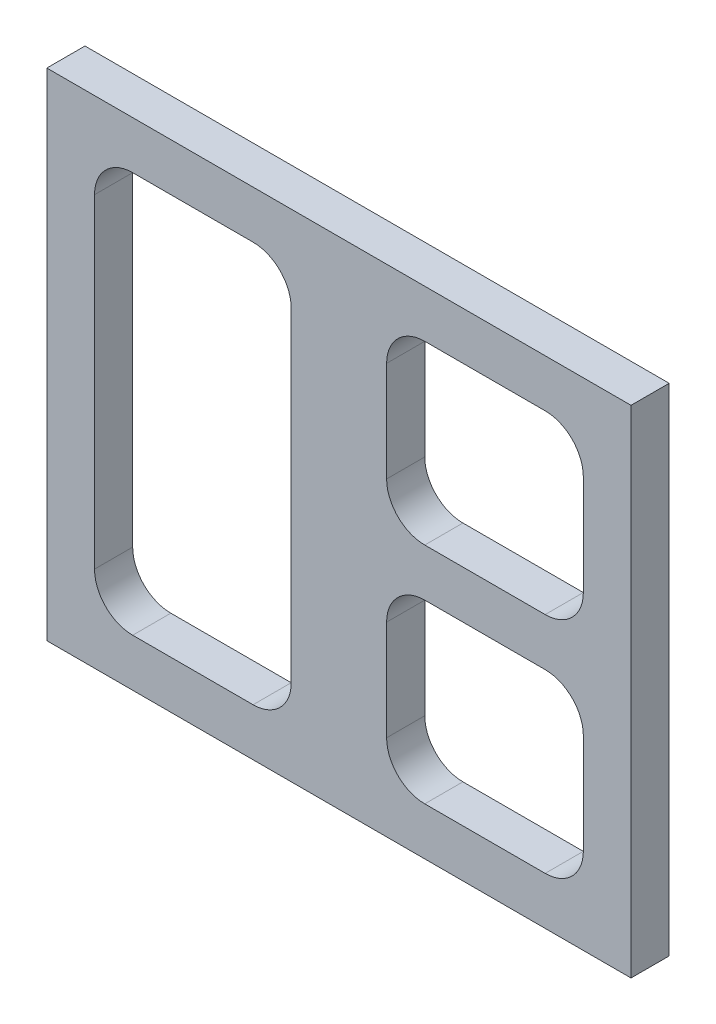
SolidWorks part; units mm, degrees
ref_plane "Спереди" through (0, 0, 0) normal (0, 0, 1) x (1, 0, 0)
ref_plane "Сверху" through (0, 0, 0) normal (0, 1, 0) x (1, 0, 0)
ref_plane "Справа" through (0, 0, 0) normal (1, 0, 0) x (0, 0, -1)
sketch "Эскиз1" plane through (0, 0, 0) normal (0, 0, 1) x (1, 0, 0)
  line L0 (-102.5, 68) -> (-102.5, -68)
  line L1 (-122.5, 104) -> (122.5, 104)
  line L2 (-122.5, 104) -> (-122.5, -104)
  line L3 (-122.5, -104) -> (122.5, -104)
  line L4 (122.5, 104) -> (122.5, -104)
  line L5 (-122.5, 104) -> (122.5, -104) construction
  line L6 (-122.5, -104) -> (122.5, 104) construction
  line L7 (-86.5, -84) -> (-36, -84)
  line L8 (102.5, 68) -> (102.5, 26)
  line L9 (-86.5, 84) -> (-36, 84)
  line L10 (-20, 68) -> (-20, -68)
  line L11 (20, 68) -> (20, 26)
  line L12 (36, 84) -> (86.5, 84)
  line L13 (36, -84) -> (86.5, -84)
  line L14 (-102.5, 84) -> (102.5, 84) construction
  line L15 (-102.5, 84) -> (-102.5, -84) construction
  line L16 (-102.5, -84) -> (102.5, -84) construction
  line L17 (102.5, 84) -> (102.5, -84) construction
  line L18 (36, 10) -> (86.5, 10)
  line L19 (36, -10) -> (86.5, -10)
  line L20 (20, -26) -> (20, -68)
  line L21 (102.5, -26) -> (102.5, -68)
  arc A0 (-102.5, 68) -> (-86.5, 84) centre (-86.5, 68) cw
  arc A1 (-20, 68) -> (-36, 84) centre (-36, 68) ccw
  arc A2 (-20, -68) -> (-36, -84) centre (-36, -68) cw
  arc A3 (-102.5, -68) -> (-86.5, -84) centre (-86.5, -68) ccw
  arc A4 (20, 68) -> (36, 84) centre (36, 68) cw
  arc A5 (102.5, 68) -> (86.5, 84) centre (86.5, 68) ccw
  arc A6 (86.5, -84) -> (102.5, -68) centre (86.5, -68) ccw
  arc A7 (20, -68) -> (36, -84) centre (36, -68) ccw
  arc A8 (36, 10) -> (20, 26) centre (36, 26) cw
  arc A9 (86.5, 10) -> (102.5, 26) centre (86.5, 26) ccw
  arc A10 (86.5, -10) -> (102.5, -26) centre (86.5, -26) cw
  arc A11 (36, -10) -> (20, -26) centre (36, -26) ccw
  point P0 (0, 0)
  point P34 (20, -84)
  point P45 (102.5, -10)
  dimension "D4" = 16
  dimension "D5" = 16
  dimension "D6" = 16
  dimension "D7" = 16
  dimension "D8" = 16
  dimension "D9" = 16
  dimension "D10" = 16
  dimension "D11" = 16
  dimension "D12" = 16
  dimension "D13" = 16
  dimension "D14" = 16
  dimension "D15" = 16
  dimension "D1" = 245
  dimension "D2" = 208
  dimension "D3" = 20
extrude "Бобышка-Вытянуть1" add sketch "Эскиз1" along normal blind 16
fillet "Скругление1" [suppressed] radius 8
fillet "Скругление2" [suppressed] radius 8
fillet "Скругление3" [suppressed] radius 8
